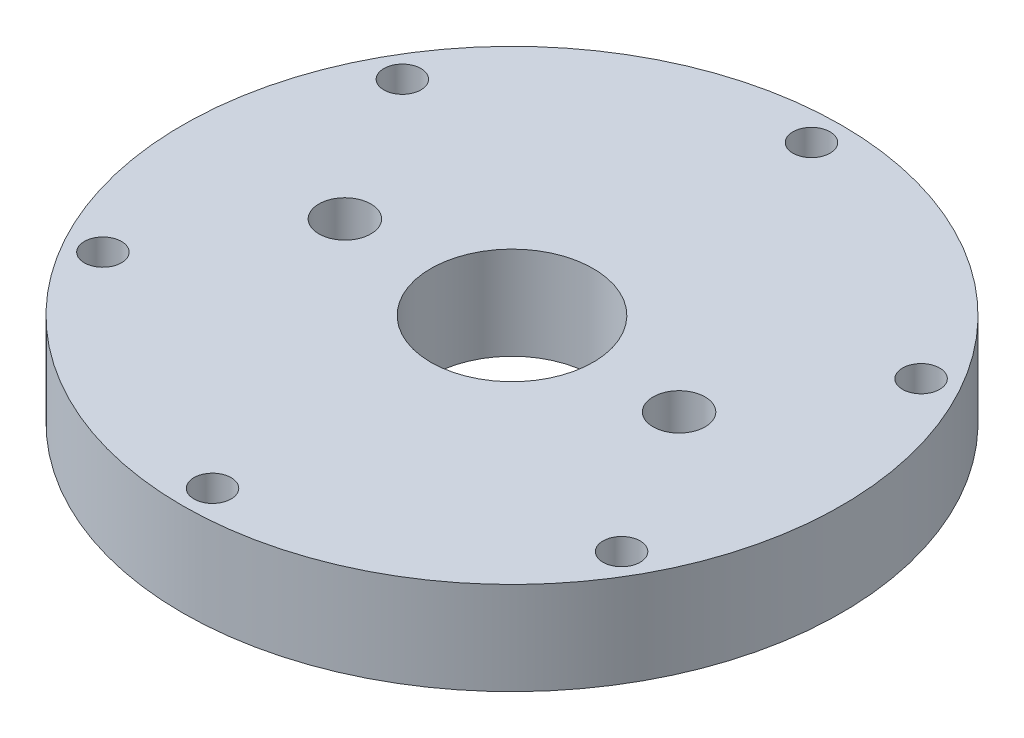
SolidWorks part; units mm, degrees
ref_plane "Front Plane" through (0, 0, 0) normal (0, 0, 1) x (1, 0, 0)
ref_plane "Top Plane" through (0, 0, 0) normal (0, 1, 0) x (1, 0, 0)
ref_plane "Right Plane" through (0, 0, 0) normal (1, 0, 0) x (0, 0, -1)
sketch "Sketch2" plane through (0, 0, 0) normal (0, 1, 0) x (1, 0, 0)
  line L0 (-11.43, 0) -> (11.43, 0) construction
  circle A0 centre (0, 0) radius 22.5425
  circle A1 centre (0, 0) radius 20.4851 construction
  circle A2 centre (0, 0) radius 5.5562
  circle A3 centre (0, 20.4851) radius 1.27
  circle A4 centre (17.7406, 10.2426) radius 1.27
  circle A5 centre (17.7406, -10.2425) radius 1.27
  circle A6 centre (0, -20.4851) radius 1.27
  circle A7 centre (-17.7406, -10.2426) radius 1.27
  circle A8 centre (-17.7406, 10.2425) radius 1.27
  circle A9 centre (11.43, 0) radius 1.778
  circle A10 centre (-11.43, 0) radius 1.778
  point P19 (0, 0)
  dimension "D1" = 11.1125
  dimension "D2" = 40.9702
  dimension "D3" = 2.54
  dimension "D5" = 45.085
  dimension "D6" = 22.86
  dimension "D7" = 3.556
  dimension "D4" = 6
extrude "Boss-Extrude1" add sketch "Sketch2" along normal blind 6.35
